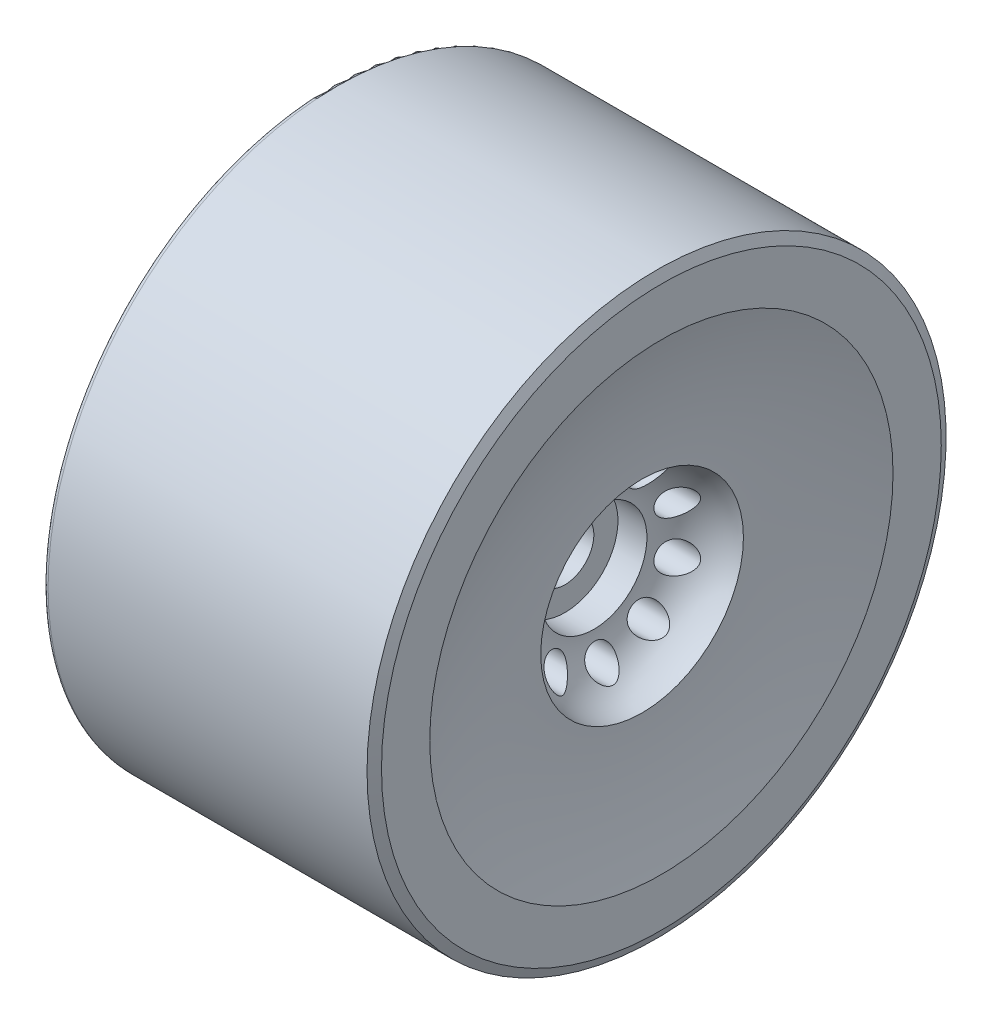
SolidWorks part; units mm, degrees
ref_plane "Front Plane" through (0, 0, 0) normal (0, 0, 1) x (1, 0, 0)
ref_plane "Top Plane" through (0, 0, 0) normal (0, 1, 0) x (1, 0, 0)
ref_plane "Right Plane" through (0, 0, 0) normal (1, 0, 0) x (0, 0, -1)
sketch "Sketch1" plane through (0, 0, 0) normal (0, 0, 1) x (1, 0, 0)
  line L0 (-0.8725, 0) -> (40.8738, 0) construction
  line L1 (-42, 60) -> (25, 60)
  line L2 (25, 60) -> (26, 58)
  line L3 (26, 58) -> (26, 48)
  line L9 (-43, 40) -> (-43, 80.8099) construction
  line L10 (-12, 11) -> (-6, 11)
  line L11 (-6, 11) -> (-6, 6)
  line L12 (-6, 6) -> (6, 6)
  line L13 (6, 6) -> (6, 11)
  line L14 (6, 11) -> (12, 11)
  line L16 (-15.8609, 18.8938) -> (-43, 40)
  arc A3 (-42, 60) -> (-43, 40) centre (157.5, 40) ccw
  arc A4 (-12, 11) -> (-15.8609, 18.8938) centre (-22, 11) ccw
  arc A5 (12, 11) -> (22, 21) centre (22, 11) cw
  arc A6 (26, 48) -> (22, 21) centre (115.125, 21) ccw
  point P2 (0, 6)
  dimension "D5" = 1
  dimension "D2" = 10
  dimension "D1" = 6
  dimension "D3" = 60
  dimension "D4" = 11
  dimension "D6" = 67
  dimension "D7" = 12
  dimension "D8" = 31
  dimension "D9" = 1
  dimension "D10" = 2
  dimension "D11" = 12
  dimension "D14" = 10
  dimension "D15" = 20
revolve "Revolve1" add sketch "Sketch1" angle 360 about L0
fillet "Fillet1" radius 1 2 edges at (-43, 0, 40) (-42, 0, 60)
sketch "Sketch2" plane through (26, 0, 0) normal (1, 0, 0) x (0, 0, -1)
  circle A0 centre (0, 0) radius 21 construction
  circle A1 centre (0, 0) radius 21 construction
  circle A2 centre (0, 16) radius 3
  circle A3 centre (0, 0) radius 16 construction
  circle A4 centre (9.4046, 12.9443) radius 3
  circle A5 centre (15.2169, 4.9443) radius 3
  circle A6 centre (15.2169, -4.9443) radius 3
  circle A7 centre (9.4046, -12.9443) radius 3
  circle A8 centre (0, -16) radius 3
  circle A9 centre (-9.4046, -12.9443) radius 3
  circle A10 centre (-15.2169, -4.9443) radius 3
  circle A11 centre (-15.2169, 4.9443) radius 3
  circle A12 centre (-9.4046, 12.9443) radius 3
  point P26 (0, 0)
  dimension "D1" = 6
  dimension "D2" = 16
  dimension "D3" = 10
extrude "Cut-Extrude1" cut sketch "Sketch2" against normal through all
